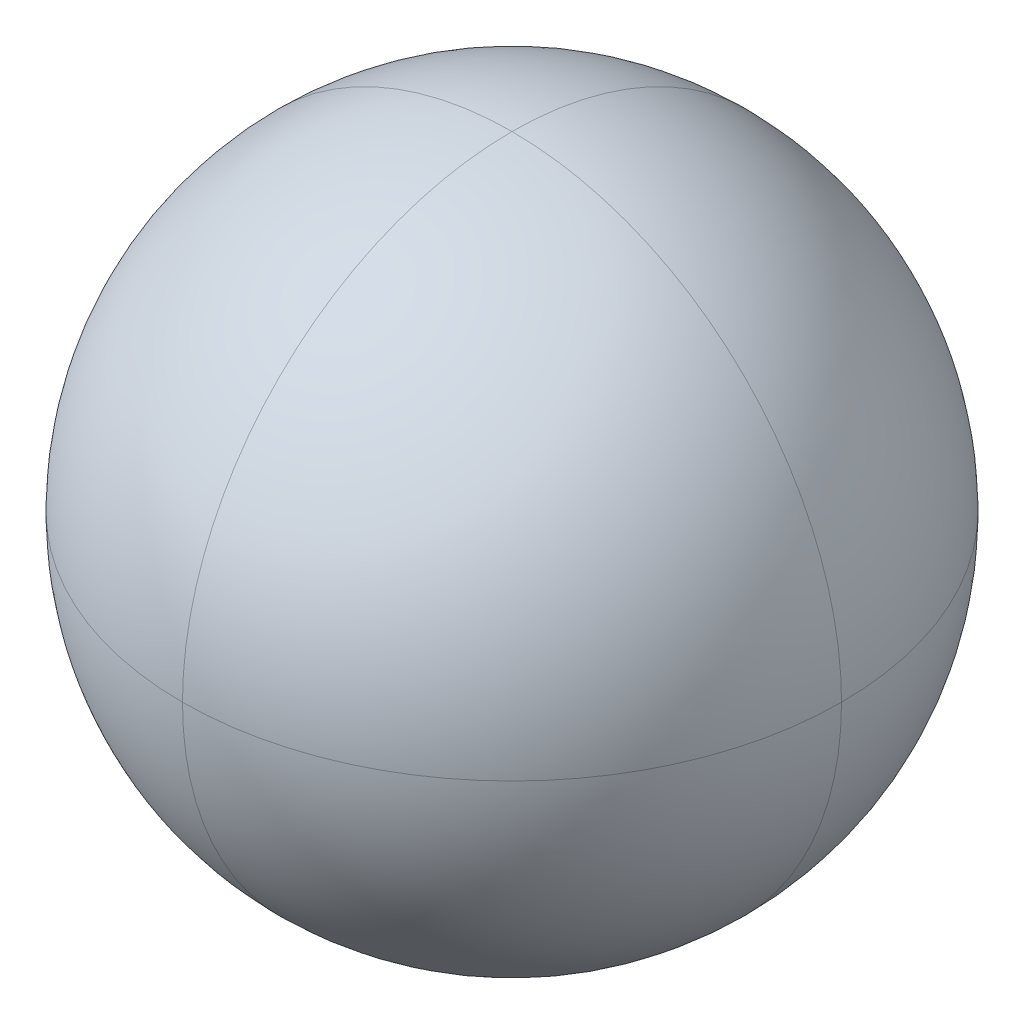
SolidWorks part; units mm, degrees
ref_plane "Vorne" through (0, 0, 0) normal (0, 0, 1) x (1, 0, 0)
ref_plane "Oben" through (0, 0, 0) normal (0, 1, 0) x (1, 0, 0)
ref_plane "Rechts" through (0, 0, 0) normal (1, 0, 0) x (0, 0, -1)
sketch "Skizze1" plane through (0, 0, 0) normal (0, 0, 1) x (1, 0, 0)
  line L0 (-25, -25) -> (25, 25) construction
  line L1 (-25, 25) -> (25, 25)
  line L2 (-25, 25) -> (-25, -25)
  line L3 (-25, -25) -> (25, -25)
  line L4 (25, 25) -> (25, -25)
  dimension "D1" = 50
extrude "Linear austragen1" add sketch "Skizze1" along normal mid plane 50
fillet "Verrundung1" radius 25 8 edges at (0, -25, 25) (0, -25, -25) (0, 25, 25) (0, 25, -25) (-25, 0, -25) (25, 0, -25) (-25, 0, 25) (25, 0, 25)
